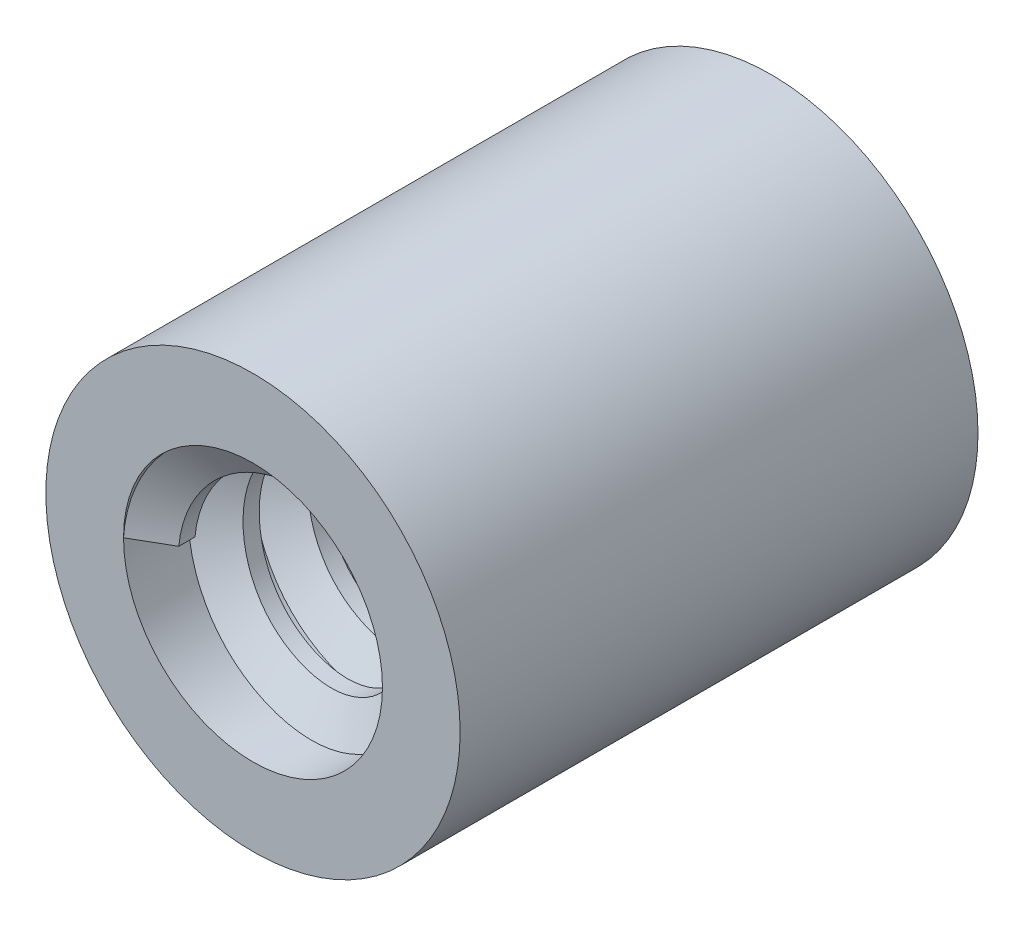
SolidWorks part; units mm, degrees
ref_plane "Ebene vorne" through (0, 0, 0) normal (0, 0, 1) x (1, 0, 0)
ref_plane "Ebene oben" through (0, 0, 0) normal (0, 1, 0) x (1, 0, 0)
ref_plane "Ebene rechts" through (0, 0, 0) normal (1, 0, 0) x (0, 0, -1)
sketch "Skizze1" plane through (0, 0, 0) normal (0, 0, 1) x (1, 0, 0)
  circle A1 centre (0, 0) radius 1.6
  circle A2 centre (0, 0) radius 1
  dimension "D1" = 2
  dimension "D2" = 3.2
extrude "Aufsatz-Linear austragen1" add sketch "Skizze1" along normal mid plane 4
thread "Gewinde1" pitch 0.5 start angle 0, offset 0, length 0, pitch 0.5, diameter 2
ref_plane "Ebene1" through (-1, 0, 2) normal (0, -1, 0) x (-1, 0, 0)
sketch "Gewindeprofil1" plane through (-1, 0, 2) normal (0, -1, 0) x (-1, 0, 0)
  line L0 (0, 0) -> (0, 0.5) construction
  line L11 (0, 0) -> (0, 0.4375)
  line L12 (0, 0.4375) -> (-0.2706, 0.2812)
  line L13 (-0.2706, 0.2812) -> (-0.2706, 0.1562)
  line L15 (-0.2706, 0.1562) -> (0, 0)
  line L17 (-0.2706, 0.2187) -> (0, 0.2187) construction
  point P2 (0, 0)
  dimension "Pitch" = 0.5
  dimension "Profile_Angle" = 60
  dimension "Profile_Land" = 0.125
  dimension "Profile_Height" = 0.2706
